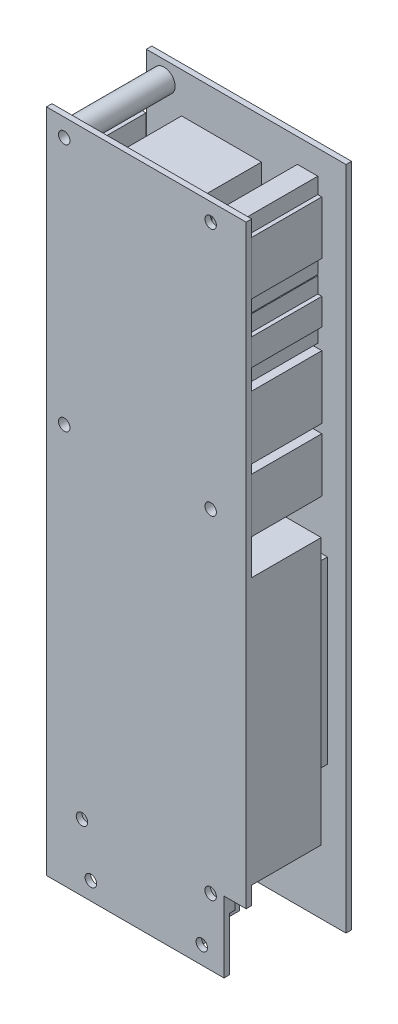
SolidWorks part; units mm, degrees
ref_plane "Front" through (0, 0, 0) normal (0, 0, 1) x (1, 0, 0)
ref_plane "Top" through (0, 0, 0) normal (0, 1, 0) x (1, 0, 0)
ref_plane "Right" through (0, 0, 0) normal (1, 0, 0) x (0, 0, -1)
sketch "Sketch1" plane through (0, 0, 0) normal (0, 0, 1) x (1, 0, 0)
  line L2 (-57.15, 190.5) -> (-57.15, 0)
  line L3 (-57.15, 0) -> (-6.35, 0)
  line L4 (0, 190.5) -> (0, 20.32)
  line L5 (-44.45, 5.08) -> (-12.7, 5.08) construction
  line L6 (0, 190.5) -> (-57.15, 190.5)
  line L8 (-6.35, 0) -> (-6.35, 20.32)
  line L9 (-6.35, 20.32) -> (0, 20.32)
  circle A0 centre (-52.07, 185.42) radius 1.6383
  circle A1 centre (-10.16, 185.42) radius 1.6383
  circle A2 centre (-12.7, 5.08) radius 1.6383
  circle A3 centre (-44.45, 5.08) radius 1.6383
  circle A4 centre (-52.07, 114.3) radius 1.6383
  circle A5 centre (-10.16, 114.3) radius 1.6383
  dimension "D4" = 3.2766
  dimension "D6" = 44.45
  dimension "D7" = 12.7
  dimension "D10" = 52.07
  dimension "D13" = 190.5
  dimension "D2" = 114.3
  dimension "D3" = 5.08
  dimension "D8" = 20.32
  dimension "D9" = 6.35
  dimension "D11" = 10.16
  dimension "D12" = 185.42
  dimension "D15" = 57.15
extrude "PCB-Controller" add sketch "Sketch1" along normal blind 1.5875
sketch "Sketch2" plane through (0, 0, 0) normal (0, 0, 1) x (1, 0, 0)
  line L1 (-50.8, 101.6) -> (0, 101.6)
  line L2 (-50.8, 101.6) -> (-50.8, 25.4)
  line L3 (-50.8, 25.4) -> (0, 25.4)
  line L4 (0, 101.6) -> (0, 25.4)
  line L6 (0, 20.32) -> (0, 190.5) construction
  line L7 (-57.15, 0) -> (-6.35, 0) construction
  dimension "D1" = 25.4
  dimension "D2" = 50.8
  dimension "D3" = 76.2
extrude "TT8" add sketch "Sketch2" against normal blind 19.8882
sketch "Sketch8" plane through (0, 0, 0) normal (0, 0, -1) x (-1, 0, 0)
  line L0 (10.16, 114.3) -> (52.07, 114.3) construction
  line L1 (7.239, 153.416) -> (7.239, 148.844)
  line L2 (12.065, 110.1852) -> (50.165, 110.1852)
  line L3 (12.065, 110.1852) -> (12.065, 104.14)
  line L4 (12.065, 104.14) -> (50.165, 104.14)
  line L5 (7.239, 170.434) -> (7.239, 165.862)
  line L6 (7.239, 185.674) -> (11.3284, 185.674)
  line L7 (7.239, 161.036) -> (11.3284, 161.036)
  line L8 (7.239, 170.434) -> (11.3284, 170.434)
  line L9 (11.3284, 185.674) -> (11.3284, 170.434)
  line L10 (0, 101.6) -> (50.8, 101.6) construction
  line L11 (50.546, 181.356) -> (56.896, 181.356)
  line L12 (50.546, 181.356) -> (50.546, 167.3098)
  line L13 (50.546, 167.3098) -> (56.896, 167.3098)
  line L14 (56.896, 181.356) -> (56.896, 167.3098)
  line L15 (47.625, 190.5) -> (47.625, 114.3) construction
  line L16 (7.239, 153.416) -> (11.3284, 153.416)
  line L17 (7.239, 190.246) -> (1.397, 190.246)
  line L18 (7.239, 190.246) -> (7.239, 185.674)
  line L19 (7.239, 165.862) -> (1.397, 165.862)
  line L20 (1.397, 190.246) -> (1.397, 185.674)
  line L21 (50.165, 110.1852) -> (50.165, 104.14)
  line L22 (31.115, 114.3) -> (31.115, 110.1852) construction
  line L23 (0, 190.5) -> (57.15, 190.5) construction
  line L24 (11.3284, 161.036) -> (11.3284, 153.416)
  line L25 (1.397, 185.674) -> (0.254, 185.674)
  line L26 (14.605, 114.3) -> (14.605, 190.5) construction
  line L27 (7.239, 165.608) -> (1.397, 165.608)
  line L28 (47.625, 190.5) -> (14.605, 190.5) construction
  line L29 (7.239, 165.608) -> (7.239, 161.036)
  line L30 (7.239, 148.844) -> (1.397, 148.844)
  line L31 (0.254, 185.674) -> (0.254, 170.434)
  line L32 (31.115, 190.5) -> (31.115, 114.3) construction
  line L33 (1.397, 170.434) -> (0.254, 170.434)
  line L34 (1.397, 170.434) -> (1.397, 165.862)
  line L35 (0, 101.6) -> (0, 190.5) construction
  line L36 (0.254, 147.574) -> (5.969, 147.574)
  line L37 (0.254, 147.574) -> (0.254, 129.54)
  line L38 (1.397, 165.608) -> (1.397, 161.036)
  line L39 (0.254, 129.54) -> (5.969, 129.54)
  line L40 (1.397, 161.036) -> (0.254, 161.036)
  line L41 (0.254, 161.036) -> (0.254, 153.416)
  line L42 (1.397, 153.416) -> (0.254, 153.416)
  line L43 (1.397, 153.416) -> (1.397, 148.844)
  line L44 (57.15, 190.5) -> (57.15, 0) construction
  line L47 (5.969, 147.574) -> (5.969, 129.54)
  line L49 (7.62, 147.574) -> (13.335, 147.574)
  line L50 (7.62, 147.574) -> (7.62, 126.8984)
  line L51 (7.62, 126.8984) -> (13.335, 126.8984)
  line L52 (13.335, 147.574) -> (13.335, 126.8984)
  line L53 (0.254, 127) -> (5.969, 127)
  line L54 (0.254, 127) -> (0.254, 111.506)
  line L55 (0.254, 111.506) -> (5.969, 111.506)
  line L56 (5.969, 127) -> (5.969, 111.506)
  dimension "D5" = 1.27
  dimension "D2" = 6.0452
  dimension "D3" = 11.0744
  dimension "D4" = 0.254
  dimension "D6" = 14.0462
  dimension "D7" = 5.842
  dimension "D8" = 15.24
  dimension "D9" = 7.62
  dimension "D10" = 0.254
  dimension "D11" = 38.1
  dimension "D12" = 0.254
  dimension "D13" = 5.715
  dimension "D14" = 6.985
  dimension "D15" = 4.572
  dimension "D16" = 6.35
  dimension "D17" = 7.62
  dimension "D18" = 2.54
  dimension "D19" = 2.54
  dimension "D20" = 18.034
  dimension "D21" = 15.494
  dimension "D22" = 20.6756
  dimension "D23" = 33.02
  dimension "D24" = 0.254
  dimension "D25" = 9.144
extrude "AmpModuConns" add sketch "Sketch8" along normal blind 20.32
sketch "Sketch15" plane through (0, 0, -19.8882) normal (0, 0, -1) x (-1, 0, 0)
  line L0 (50.8, 25.4) -> (0, 25.4) construction
  line L1 (5.08, 90.8304) -> (45.72, 90.8304)
  line L2 (5.08, 90.8304) -> (5.08, 39.4462)
  line L3 (5.08, 39.4462) -> (45.72, 39.4462)
  line L4 (45.72, 90.8304) -> (45.72, 39.4462)
  line L5 (0, 101.6) -> (50.8, 101.6) construction
  line L6 (0, 25.4) -> (0, 101.6) construction
  line L7 (50.8, 101.6) -> (50.8, 25.4) construction
  dimension "D1" = 14.0462
  dimension "D2" = 10.7696
  dimension "D3" = 5.08
  dimension "D4" = 5.08
extrude "Extrude10" add sketch "Sketch15" along normal blind 6.858
sketch "Sketch6" plane through (0, 0, 0) normal (0, 0, -1) x (-1, 0, 0)
  line L0 (57.15, 0) -> (6.35, 0) construction
  line L1 (6.35, 15.24) -> (50.8, 15.24)
  line L2 (6.35, 15.24) -> (6.35, 40.64)
  line L3 (6.35, 40.64) -> (50.8, 40.64)
  line L4 (50.8, 15.24) -> (50.8, 40.64)
  line L6 (50.8, 101.6) -> (50.8, 25.4) construction
  dimension "D1" = 25.4
  dimension "D2" = 44.45
  dimension "D3" = 15.24
extrude "Ref PCB" add sketch "Sketch6" along normal blind 1.5875
sketch "Sketch7" plane through (0, -1.27, 0) normal (0, 0, -1) x (-1, 0, 0)
  line L1 (6.35, 1.27) -> (6.35, 16.51) construction
  line L2 (6.35, 16.51) -> (50.8, 16.51) construction
  line L3 (50.8, 16.51) -> (50.8, 26.67) construction
  circle A0 centre (10.16, 20.32) radius 1.6383
  circle A2 centre (46.99, 20.32) radius 1.6383
  circle A3 centre (10.16, 186.69) radius 1.6383 construction
  dimension "D3" = 3.81
  dimension "D2" = 3.81
  dimension "D1" = 3.81
extrude "Ref holes" cut sketch "Sketch7" against normal through all
sketch "Sketch17" plane through (0, 0, 0) normal (0, 0, -1) x (-1, 0, 0)
  line L1 (45.1569, 15.875) -> (48.8231, 15.875)
  line L2 (48.8231, 15.875) -> (50.6562, 19.05)
  line L3 (50.6562, 19.05) -> (48.8231, 22.225)
  line L4 (48.8231, 22.225) -> (45.1569, 22.225)
  line L5 (45.1569, 22.225) -> (43.3238, 19.05)
  line L6 (43.3238, 19.05) -> (45.1569, 15.875)
  line L7 (6.4938, 19.05) -> (8.3269, 15.875)
  line L8 (8.3269, 15.875) -> (11.9931, 15.875)
  line L9 (11.9931, 15.875) -> (13.8262, 19.05)
  line L10 (13.8262, 19.05) -> (11.9931, 22.225)
  line L11 (11.9931, 22.225) -> (8.3269, 22.225)
  line L12 (8.3269, 22.225) -> (6.4938, 19.05)
  circle A0 centre (46.99, 19.05) radius 3.175 construction
  circle A1 centre (10.16, 19.05) radius 3.175 construction
  circle A2 centre (46.99, 19.05) radius 1.6383 construction
  circle A3 centre (10.16, 19.05) radius 1.6383 construction
  dimension "D1" = 6.35
extrude "Extrude13" add sketch "Sketch17" along normal blind 5.08
sketch "Sketch21" plane through (-56.896, 0, 0) normal (-1, 0, 0) x (0, 0, 1)
  line L1 (0, 190.5) -> (0, 0) construction
  circle A0 centre (-6.3246, 157.226) radius 6.35
  dimension "D1" = 12.7
  dimension "D2" = 6.3246
  dimension "D3" = 33.274
extrude "Extrude18" add sketch "Sketch21" against normal blind 31.75
sketch "Sketch22" plane through (0, 0, 0) normal (0, 0, -1) x (-1, 0, 0)
  line L0 (0, 190.5) -> (57.15, 190.5) construction
  line L1 (13.97, 189.23) -> (36.83, 189.23)
  line L2 (13.97, 189.23) -> (13.97, 178.308)
  line L3 (13.97, 178.308) -> (36.83, 178.308)
  line L4 (36.83, 189.23) -> (36.83, 178.308)
  line L5 (57.15, 190.5) -> (57.15, 0) construction
  dimension "D1" = 1.27
  dimension "D2" = 22.86
  dimension "D3" = 10.922
  dimension "D4" = 20.32
extrude "Extrude19" add sketch "Sketch22" along normal blind 16.764
sketch "Sketch23" plane through (0, 110.1852, 0) normal (0, 1, 0) x (1, 0, 0)
  line L0 (-50.165, 20.32) -> (-12.065, 20.32) construction
  line L1 (-46.99, 19.812) -> (-15.24, 19.812)
  line L2 (-46.99, 19.812) -> (-46.99, 18.542)
  line L3 (-46.99, 18.542) -> (-15.24, 18.542)
  line L4 (-15.24, 19.812) -> (-15.24, 18.542)
  line L5 (-31.115, 20.32) -> (-31.115, 19.812) construction
  dimension "D1" = 0.508
  dimension "D2" = 1.27
  dimension "D3" = 31.75
extrude "Extrude20" add sketch "Sketch23" along normal blind 25.4 and the other way blind 7.239
sketch "Sketch24" plane through (0, 0, 0) normal (0, 0, -1) x (-1, 0, 0)
  line L0 (57.15, 0) -> (6.35, 0) construction
  line L1 (57.15, 190.5) -> (57.15, 0) construction
  line L3 (52.07, 1.27) -> (54.61, 1.27)
  line L4 (52.07, 1.27) -> (52.07, 6.35)
  line L5 (52.07, 6.35) -> (54.61, 6.35)
  line L6 (54.61, 1.27) -> (54.61, 6.35)
  line L7 (52.07, 8.89) -> (54.61, 8.89)
  line L8 (52.07, 8.89) -> (52.07, 13.97)
  line L9 (52.07, 13.97) -> (54.61, 13.97)
  line L10 (54.61, 8.89) -> (54.61, 13.97)
  circle A0 centre (34.29, 9.525) radius 8.636
  dimension "D1" = 17.272
  dimension "D2" = 9.525
  dimension "D3" = 22.86
  dimension "D4" = 5.08
  dimension "D5" = 2.54
  dimension "D6" = 2.54
  dimension "D7" = 2.54
  dimension "D8" = 1.27
extrude "Extrude21" add sketch "Sketch24" along normal blind 10.16
sketch "Sketch25" plane through (0, 0, 0) normal (0, 0, -1) x (-1, 0, 0)
  line L0 (57.15, 190.5) -> (57.15, 0) construction
  line L1 (50.8, 41.402) -> (56.896, 41.402)
  line L2 (50.8, 41.402) -> (50.8, 47.498)
  line L3 (50.8, 47.498) -> (56.896, 47.498)
  line L4 (56.896, 41.402) -> (56.896, 47.498)
  line L5 (57.15, 0) -> (6.35, 0) construction
  dimension "D1" = 0.254
  dimension "D2" = 6.096
  dimension "D3" = 41.402
extrude "Extrude22" add sketch "Sketch25" along normal blind 5.08
pattern_linear "LPattern2" count 4 spacing 15.24 along (0, 1, 0) of "Extrude22"
sketch "Sketch28" plane through (0, 0, 0) normal (0, 0, -1) x (-1, 0, 0)
  circle A0 centre (10.16, 114.3) radius 3.175
  circle A1 centre (52.07, 114.3) radius 3.175
  circle A2 centre (52.07, 185.42) radius 3.175
  circle A3 centre (52.07, 185.42) radius 1.6383
  circle A4 centre (10.16, 114.3) radius 1.6383
  circle A5 centre (52.07, 114.3) radius 1.6383
  dimension "D1" = 6.35
extrude "Cover Standoffs" add sketch "Sketch28" along normal blind 26.9875
sketch "Sketch29" plane through (0, 0, -26.9875) normal (0, 0, -1) x (-1, 0, 0)
  line L0 (0, 25.4) -> (0, 101.6) construction
  line L1 (57.15, 190.5) -> (0, 190.5)
  line L2 (57.15, 190.5) -> (57.15, 0)
  line L3 (57.15, 0) -> (0, 0)
  line L4 (0, 190.5) -> (0, 0)
  line L5 (57.15, 0) -> (6.35, 0) construction
extrude "Top Cover" add sketch "Sketch29" along normal blind 1.5875
sketch "Sketch30" plane through (0, 0, 0) normal (0, 0, -1) x (-1, 0, 0)
  line L0 (6.35, 0) -> (6.35, 15.24) construction
  line L1 (16.5151, 1.2446) -> (25.4051, 1.2446)
  line L2 (16.5151, 1.2446) -> (16.5151, 21.2598)
  line L3 (16.5151, 21.2598) -> (25.4051, 21.2598)
  line L4 (25.4051, 1.2446) -> (25.4051, 21.2598)
  line L5 (57.15, 0) -> (6.35, 0) construction
  dimension "D1" = 10.1651
  dimension "D2" = 1.2446
  dimension "D3" = 20.0152
  dimension "D4" = 8.89
extrude "Extrude23" add sketch "Sketch30" along normal blind 9.525
sketch "Sketch31" plane through (0, 0, -9.525) normal (0, 0, -1) x (-1, 0, 0)
  line L0 (20.9601, 19.7612) -> (20.9601, 21.2598) construction
  line L1 (18.0391, 2.7432) -> (23.8811, 2.7432)
  line L2 (18.0391, 2.7432) -> (18.0391, 19.7612)
  line L3 (18.0391, 19.7612) -> (23.8811, 19.7612)
  line L4 (23.8811, 2.7432) -> (23.8811, 19.7612)
  line L5 (25.4051, 21.2598) -> (16.5151, 21.2598) construction
  line L6 (20.9601, 2.7432) -> (20.9601, 1.2446) construction
  line L7 (16.5151, 1.2446) -> (25.4051, 1.2446) construction
  dimension "D1" = 5.842
  dimension "D2" = 17.018
extrude "Extrude24" add sketch "Sketch31" along normal blind 5.08
